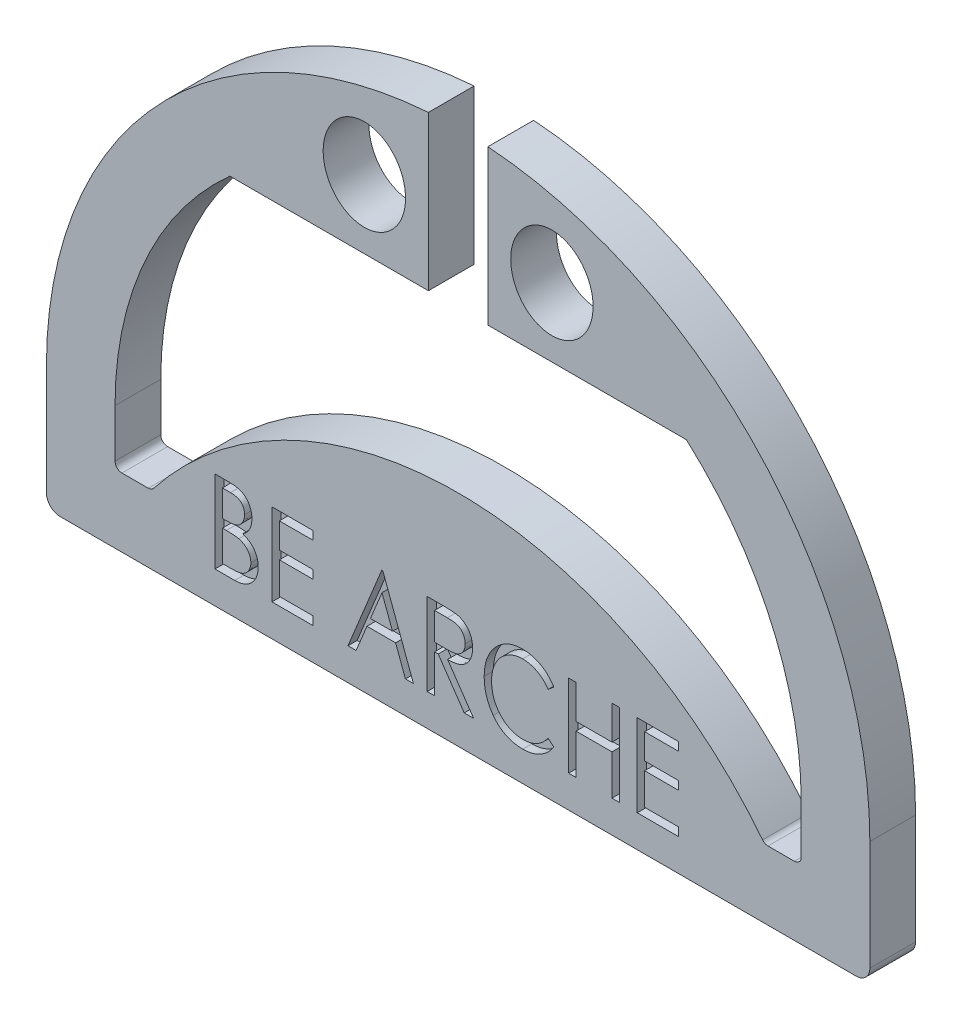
SolidWorks part; units mm, degrees
ref_plane "Plan de face" through (0, 0, 0) normal (0, 0, 1) x (1, 0, 0)
ref_plane "Plan de dessus" through (0, 0, 0) normal (0, 1, 0) x (1, 0, 0)
ref_plane "Plan de droite" through (0, 0, 0) normal (1, 0, 0) x (0, 0, -1)
sketch "Esquisse1" plane through (0, 0, 0) normal (0, 0, 1) x (1, 0, 0)
  line L0 (-158.3393, 0) -> (245.0092, 0) construction
  line L1 (0, -55.3377) -> (0, 353.7921) construction
  line L2 (-79.3526, -12) -> (109.1218, -12) construction
  line L3 (75, 0) -> (75, -16.1445) construction
  line L4 (-7.4455, 21) -> (12.4133, 21) construction
  line L5 (-62.3131, 56) -> (61.9579, 56) construction
  line L6 (67, -49.8354) -> (67, -7.5458) construction
  line L7 (6.5, 98.2932) -> (6.5, 44.6424) construction
  line L8 (20.5, 94.3913) -> (20.5, 62.4795) construction
  line L9 (12.4133, 71) -> (34.1833, 71) construction
  line L10 (-67, -49.8354) -> (-67, -7.5458) construction
  line L11 (-390.3547, -27) -> (366.2536, -27) construction
  line L12 (67.7348, -12) -> (73.5, -12)
  line L13 (49.8899, 56) -> (6.5, 56)
  line L14 (6.5, 56) -> (6.5, 89.765)
  line L15 (75, 0) -> (75, -10.5)
  line L16 (90, 0) -> (90, -24)
  line L17 (-6.5, 56) -> (-6.5, 89.765)
  line L18 (-90, -59.8279) -> (-90, 0) construction
  line L19 (-49.8899, 56) -> (-6.5, 56)
  line L20 (-90, 0) -> (-90, -24)
  line L21 (90, -55.3377) -> (90, 160.9755) construction
  line L22 (-75, 0) -> (-75, -10.5)
  line L23 (-67.7348, -12) -> (-73.5, -12)
  line L24 (-87, -27) -> (87, -27)
  arc A0 (90, 0) -> (-90, 0) centre (0, 0) ccw construction
  arc A1 (75, 0) -> (-75, 0) centre (0, 0) ccw construction
  arc A2 (-66.5536, -11.4245) -> (66.5536, -11.4245) centre (0, -63.5152) cw
  arc A3 (75, 0) -> (49.8899, 56) centre (0, 0) ccw
  arc A4 (90, 0) -> (6.5, 89.765) centre (0, 0) ccw
  arc A5 (-75, 0) -> (-49.8899, 56) centre (0, 0) cw
  arc A6 (-90, 0) -> (-6.5, 89.765) centre (0, 0) cw
  arc A7 (-90, -24) -> (-87, -27) centre (-87, -24) ccw
  arc A8 (90, -24) -> (87, -27) centre (87, -24) cw
  arc A9 (75, -10.5) -> (73.5, -12) centre (73.5, -10.5) cw
  arc A10 (-75, -10.5) -> (-73.5, -12) centre (-73.5, -10.5) ccw
  arc A11 (-66.5536, -11.4245) -> (-67.7348, -12) centre (-67.7348, -10.5) cw
  arc A12 (66.5536, -11.4245) -> (67.7348, -12) centre (67.7348, -10.5) ccw
  ellipse E0 centre (20.5, 71) end of major axis (20.5, 81) minor radius 9
  ellipse E1 centre (-20.5, 71) end of major axis (-20.5, 81) minor radius 9
  point P58 (-90, -27)
  point P61 (90, -27)
  point P64 (75, -12)
  point P67 (-75, -12)
  point P70 (-67, -12)
  point P73 (67, -12)
  dimension "D1" = 15
  dimension "D8" = 3
  dimension "D9" = 1.5
  dimension "D2" = 23
  dimension "D3" = 48
  dimension "D4" = 83
  dimension "D5" = 6.5
  dimension "D6" = 14
  dimension "D7" = 15
extrude "Extrusion1" add sketch "Esquisse1" along normal blind 10
sketch "Esquisse2" plane through (0, 0, 10) normal (0, 0, 1) x (1, 0, 0)
  line L0 (-105.6098, -27) -> (113.0789, -27) construction
  line L1 (0, -57.2989) -> (0, 50.539) construction
  line L2 (-55, -20) -> (79.7892, -20) construction
  line L3 (-55, -43.2847) -> (-55, 1.6082) construction
  line L4 (-52.2766, -2) -> (54.3737, -2) construction
  line L5 (50, -57.2989) -> (50, 1.6082) construction
  text T0 "BE ARCHE" font "Century Gothic" height 18
  dimension "D1" = 7
  dimension "D2" = 18
  dimension "D3" = 55
  dimension "D4" = 50
extrude "Enlèv. mat.-Extru.1" cut sketch "Esquisse2" against normal blind 2
